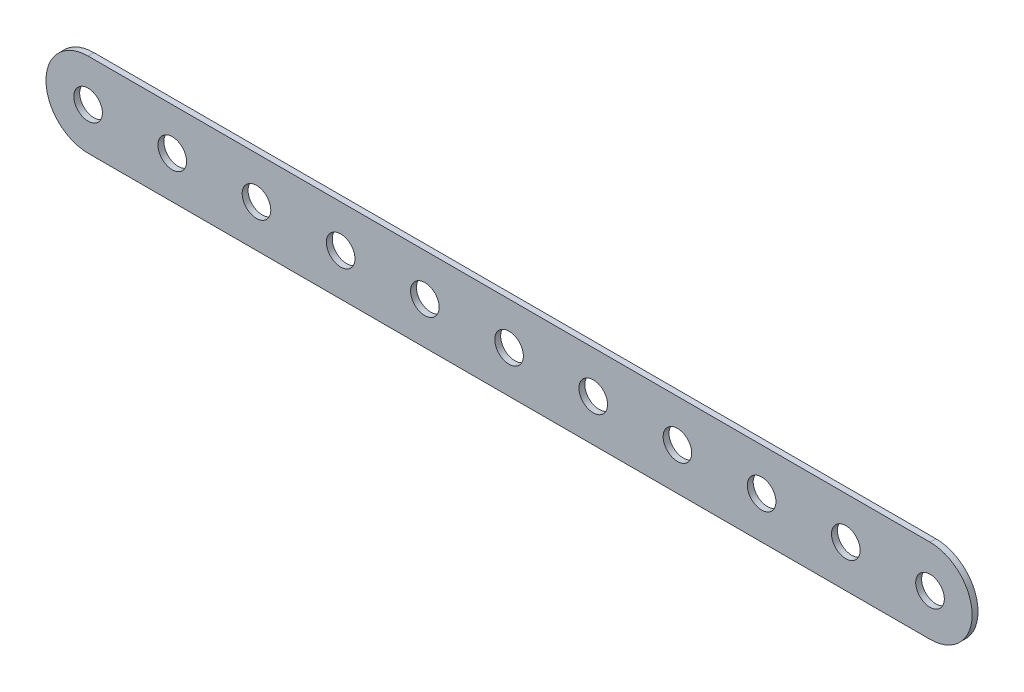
SolidWorks part; units mm, degrees
ref_plane "Front Plane" through (0, 0, 0) normal (0, 0, 1) x (1, 0, 0)
ref_plane "Top Plane" through (0, 0, 0) normal (0, 1, 0) x (1, 0, 0)
ref_plane "Right Plane" through (0, 0, 0) normal (1, 0, 0) x (0, 0, -1)
sketch "Sketch1" plane through (0, 0, 0) normal (0, 0, 1) x (1, 0, 0)
  line L0 (-63.5, 0) -> (63.5, 0) construction
  line L1 (-63.5, 6.35) -> (63.5, 6.35)
  line L2 (-63.5, -6.35) -> (63.5, -6.35)
  arc A0 (-63.5, 6.35) -> (-63.5, -6.35) centre (-63.5, 0) ccw
  arc A1 (63.5, -6.35) -> (63.5, 6.35) centre (63.5, 0) ccw
  point P2 (0, 0)
  point P8 (69.85, 0)
  point P9 (-69.85, 0)
  dimension "D1" = 12.7
  dimension "D2" = 139.7
extrude "Boss-Extrude1" add sketch "Sketch1" along normal blind 0.889
sketch "Sketch2" plane through (0, 0, 0.889) normal (0, 0, 1) x (1, 0, 0)
  circle A0 centre (-63.5, 0) radius 2.159
  circle A1 centre (-50.8, 0) radius 2.159
  circle A2 centre (-38.1, 0) radius 2.159
  circle A3 centre (-25.4, 0) radius 2.159
  circle A4 centre (-12.7, 0) radius 2.159
  circle A5 centre (0, 0) radius 2.159
  circle A6 centre (12.7, 0) radius 2.159
  circle A7 centre (25.4, 0) radius 2.159
  circle A8 centre (38.1, 0) radius 2.159
  circle A9 centre (50.8, 0) radius 2.159
  circle A10 centre (63.5, 0) radius 2.159
  dimension "D1" = 4.318
  dimension "D2" = 11
extrude "Cut-Extrude1" cut sketch "Sketch2" against normal through all
